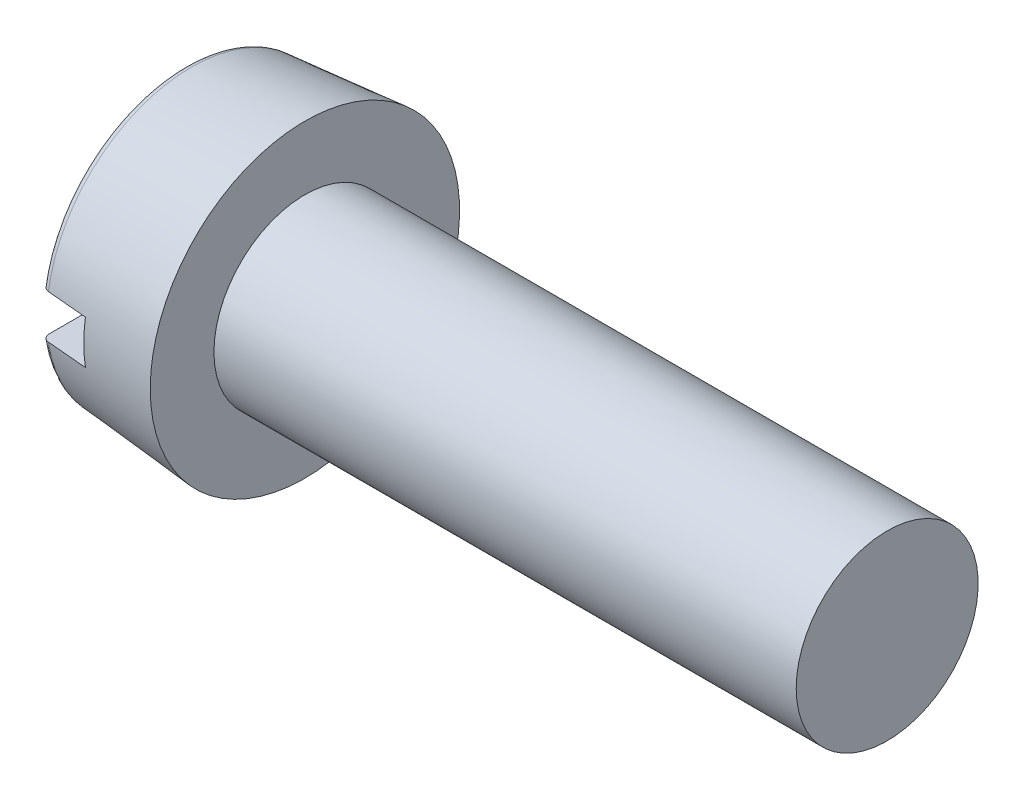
SolidWorks part; units mm, degrees
ref_plane "Plane1" through (0, 0, 0) normal (0, 0, 1) x (1, 0, 0)
ref_plane "Plane2" through (0, 0, 0) normal (0, 1, 0) x (1, 0, 0)
ref_plane "Plane3" through (0, 0, 0) normal (1, 0, 0) x (0, 0, -1)
sketch "BodySke" plane through (0, 0, 0) normal (0, 0, 1) x (1, 0, 0)
  line L0 (3.3, 2.5) -> (3.3, 4.25)
  line L1 (0, 0) -> (0, 3.9613)
  line L2 (-25.4, 0) -> (127, 0) construction
  line L3 (19.3, 0) -> (0, 0)
  line L4 (3.3, 2.5) -> (19.3, 2.5)
  line L5 (19.3, 2.5) -> (19.3, 0)
  line L6 (0, 3.9613) -> (3.3, 4.25)
  line L9 (4.1, 4.0875) -> (4.1, -5.4375) construction
  line L10 (3.3, 6.35) -> (3.3, -3.175) construction
revolve "Base-Revolve" add sketch "BodySke"
fillet "Fillet1" [suppressed] radius 0.2
fillet "Fillet2" radius 0.2 1 edges at (0, 0, 3.9613)
sketch "Sketch2" plane through (0, 0, 0) normal (1, 0, 0) x (0, 0, -1)
  line L0 (4.25, -0.6) -> (-4.25, -0.6)
  line L1 (4.25, -0.6) -> (4.25, 0.6)
  line L2 (-4.25, 0.6) -> (4.25, 0.6)
  line L3 (-4.25, 0.6) -> (-4.25, -0.6)
extrude "Slot" cut sketch "Sketch2" along normal blind 1.3
sketch "ThdSchSke" plane through (0, 0, 0) normal (0, 0, 1) x (1, 0, 0)
  line L0 (4.9, -2.055) -> (4.5884, -2.5)
  line L1 (4.9, -2.055) -> (5.2116, -2.5)
  line L2 (5.2116, -2.5) -> (5.2116, -3.125)
  line L3 (-3.175, 0) -> (5.1513, 0) construction
  line L5 (5.2116, -3.125) -> (4.5884, -3.125)
  line L6 (4.5884, -3.125) -> (4.5884, -2.5)
revolve "ThreadSchematic" [suppressed] cut sketch "ThdSchSke" angle 360 about L3
pattern_linear "ThdSchPat" [suppressed]
equation "\"D1@Sketch2\" = \"Head_dia@BodySke\""
equation "\"D2@Sketch2\" = \"D1@Sketch2\" / 2"
equation "\"D3@Sketch2\" = \"Slot_width@Sketch2\" / 2"
equation "\"Thread_length@ThreadCosmetic\" = ((sgn( (\"Length@BodySke\" - \"Advance@BodySke\" * 2.0 ) - \"Thread_nom@BodySke\" )-1)*( (\"Length@BodySke\" - \"Advance@BodySke\"  * 2.0) - \"Thread_nom@BodySke\" ))/-2+ \"Thread_"
equation "\"Thread_minor@ThdSchSke\" = \"Thread_minor@ThreadCosmetic\""
equation "\"Diameter@ThdSchSke\" = \"Diameter@BodySke\""
equation "\"Overcut@ThdSchSke\" = \"Diameter@BodySke\" * 1.25"
equation "\"Start@ThdSchSke\" = \"Head_ht@BodySke\" + \"Length@BodySke\" - \"Thread_length@ThreadCosmetic\"  '---Non-countersunk---"
equation "\"Num_threads@ThdSchPat\" = int( \"Thread_length@ThreadCosmetic\" / \"Advance@BodySke\" + 0.999 )  + 1"
equation "\"Advance@ThdSchPat\" = \"Thread_length@ThreadCosmetic\" /  (\"Num_threads@ThdSchPat\" - 1) 'relax it"
